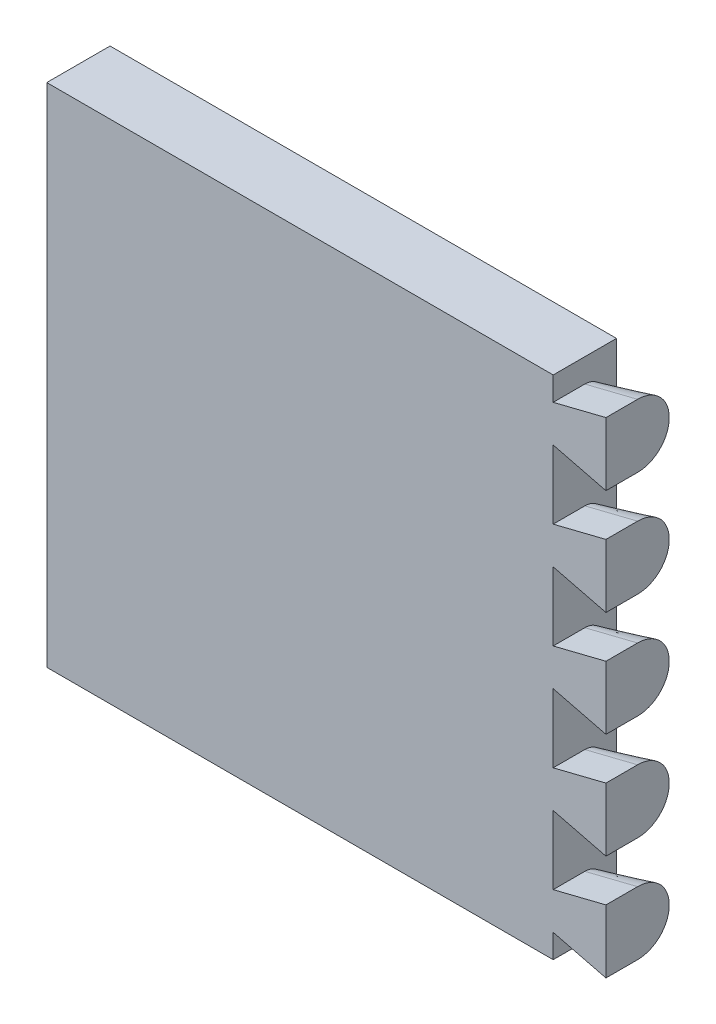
SolidWorks part; units mm, degrees
ref_plane "Front" through (0, 0, 0) normal (0, 0, 1) x (1, 0, 0)
ref_plane "Top" through (0, 0, 0) normal (0, 1, 0) x (1, 0, 0)
ref_plane "Side" through (0, 0, 0) normal (1, 0, 0) x (0, 0, -1)
sketch "Sketch1" plane through (0, 0, 0) normal (1, 0, 0) x (0, 0, -1)
  line L0 (-9.525, -76.2) -> (9.525, -76.2)
  line L1 (-9.525, -76.2) -> (-9.525, 76.2)
  line L2 (9.525, 76.2) -> (-9.525, 76.2)
  line L3 (9.525, 76.2) -> (9.525, -76.2)
  line L4 (-9.525, -76.2) -> (9.525, 76.2) construction
  dimension "D1" = 152.4
  dimension "D2" = 19.05
extrude "BasePlate" add sketch "Sketch1" along normal mid plane 152.4
ref_plane "Plane1" through (92.075, 0, 0) normal (1, 0, 0) x (0, 0, -1)
sketch "Sketch2" plane through (92.075, 0, 0) normal (1, 0, 0) x (0, 0, -1)
  line L0 (-9.525, 0) -> (0, 0) construction
  line L1 (-9.525, -76.2) -> (-9.525, 76.2) construction
  line L2 (-9.525, -9.525) -> (0, -9.525)
  line L3 (-9.525, 9.525) -> (0, 9.525)
  line L4 (9.525, 76.2) -> (9.525, -76.2) construction
  line L5 (-9.525, -9.525) -> (-9.525, 9.525)
  arc A0 (-9.525, -9.525) -> (-9.525, 9.525) centre (-9.525, 0) cw construction
  arc A1 (0, -9.525) -> (0, 9.525) centre (0, 0) ccw
  dimension "D1" = 9.525
  dimension "D2" = 9.525
extrude "Extrude1" add sketch "Sketch2" against normal up to next
draft "Draft2" type of draft neutral plane draft angle 14 faces to draft 3 parameters "D1"=14
pattern_linear "LPattern1" count 3 spacing 31.75 along (0, -1, 0) count 3 spacing 31.75 along (0, 1, 0) of "Extrude1", "Draft2"
